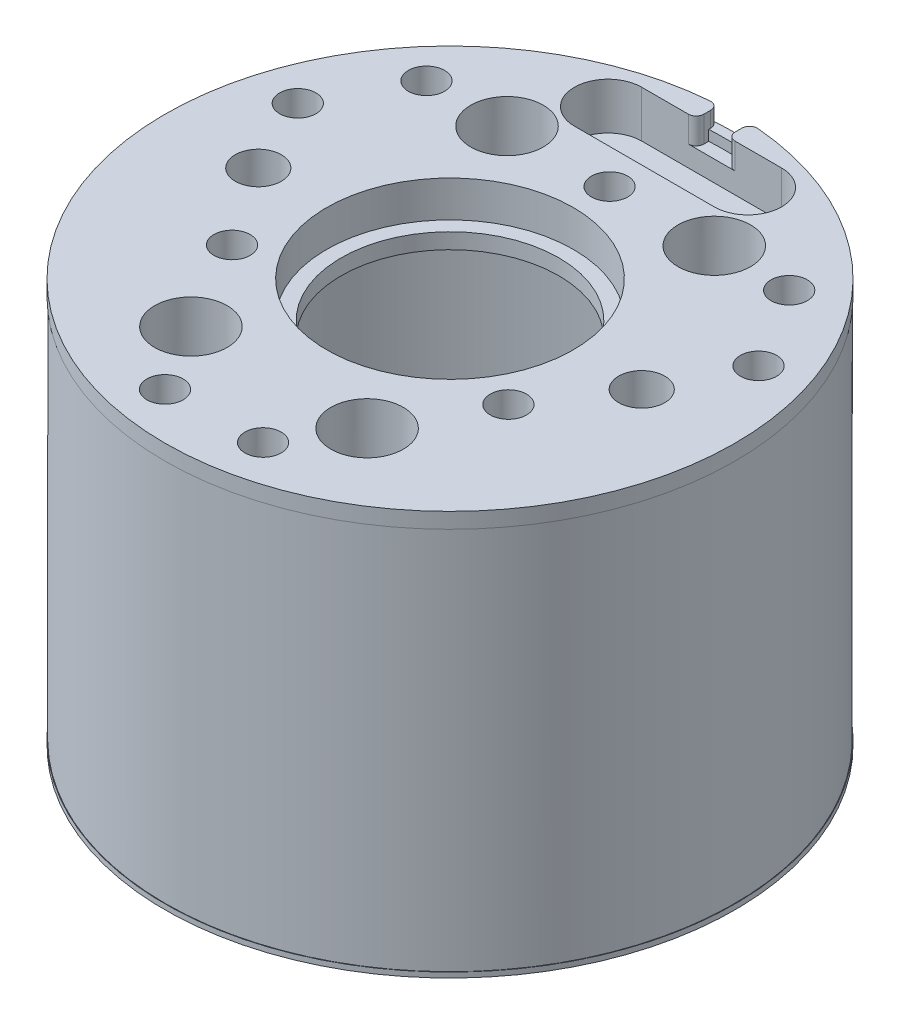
SolidWorks part; units mm, degrees
ref_plane "Front Plane" through (0, 0, 0) normal (0, 0, 1) x (1, 0, 0)
ref_plane "Top Plane" through (0, 0, 0) normal (0, 1, 0) x (1, 0, 0)
ref_plane "Right Plane" through (0, 0, 0) normal (1, 0, 0) x (0, 0, -1)
sketch "Sketch1" plane through (0, 0, 0) normal (0, 0, 1) x (1, 0, 0)
  line L0 (0, 0) -> (0, 37.5247) construction
  line L1 (13.208, -19.812) -> (13.208, 0) construction
  line L2 (13.208, -2.54) -> (13.208, -19.812)
  line L3 (13.208, -2.54) -> (5.334, -2.54)
  line L5 (6.0452, 0) -> (13.97, 0)
  line L6 (13.97, 0) -> (13.97, -0.762)
  line L7 (13.97, -0.762) -> (13.462, -0.762)
  line L8 (13.462, -0.762) -> (13.462, -19.558)
  line L9 (13.462, -19.558) -> (13.97, -19.558)
  line L10 (13.97, -19.558) -> (13.97, -19.812)
  line L11 (13.97, -19.812) -> (13.208, -19.812)
  line L12 (6.0452, 0) -> (6.0452, -1.778)
  line L13 (6.0452, -1.778) -> (5.334, -1.778)
  line L14 (5.334, -1.778) -> (5.334, -2.54)
  dimension "D1" = 19.812
  dimension "D2" = 26.416
  dimension "D3" = 0.762
  dimension "D4" = 2.54
  dimension "D5" = 19.558
  dimension "D6" = 19.812
  dimension "D7" = 27.94
  dimension "D8" = 26.924
  dimension "D9" = 12.0904
  dimension "D10" = 1.778
  dimension "D11" = 10.668
revolve "Body" add sketch "Sketch1" angle 360 about L0
sketch "Mount Holes 1" plane through (0, 0, 0) normal (0, 1, 0) x (1, 0, 0)
  line L0 (-13.5476, 7.8217) -> (13.5476, 7.8217) construction
  line L1 (13.5476, 7.8217) -> (0, -15.6435) construction
  line L2 (0, -15.6435) -> (-13.5476, 7.8217) construction
  line L3 (-13.5476, 7.8217) -> (0, 0) construction
  line L4 (0, 0) -> (13.5476, 7.8217) construction
  line L5 (0, 0) -> (0, -15.6435) construction
  line L6 (0, 0) -> (-2.286, -11.684) construction
  line L7 (0, 0) -> (-6.7738, -3.9109) construction
  line L8 (0, 0) -> (-11.176, 3.7139) construction
  line L10 (0, 0) -> (-9.398, 0) construction
  line L11 (0, 0) -> (9.398, 0) construction
  dimension "D1" = 11.684
  dimension "D2" = 2.286
  dimension "D3" = 6.7738
  dimension "D4" = 11.176
  dimension "D5" = 9.398
hole_wizard "#2-56 Tapped Hole1" positions "3DSketch1" profile "Sketch3" tap size "#2-56" standard "Ansi Inch"
sketch3d "3DSketch1"
  point P0 (-6.7738, 0, 3.9109)
  point P3 (-11.176, 0, -3.7139)
  point P6 (-2.286, 0, 11.684)
sketch "Sketch3" plane through (-6.7738, 0, 3.9109) normal (1, 0, 0) x (0, 0, 1)
  line L0 (0, 0) -> (0, 19.812)
  line L1 (0, 19.812) -> (0.889, 19.812)
  line L2 (0.889, 19.812) -> (0.889, 0)
  line L5 (0.889, 0) -> (0, 0)
  line L11 (0, -6.35) -> (0, 107.95) construction
  dimension "Thru Tap Drill Dia." = 1.778
  dimension "Thru Tap Drill Depth" = 19.812
pattern_circular "CirPattern1" count 3 over 360 about axis through (0, 0, 0) along (0, 1, 0) of "#2-56 Tapped Hole1"
hole_wizard "#4-40 Tapped Hole1" positions "3DSketch2" profile "Sketch4" tap size "#4-40" standard "Ansi Inch"
sketch3d "3DSketch2"
  point P0 (-9.398, 0, 0)
  point P3 (9.398, 0, 0)
sketch "Sketch4" plane through (-9.398, 0, 0) normal (1, 0, 0) x (0, 0, 1)
  line L0 (0, 0) -> (0, 8.2992)
  line L1 (0, 8.2992) -> (1.1303, 7.62)
  line L2 (1.1303, 7.62) -> (1.1303, 0)
  line L5 (1.1303, 0) -> (0, 0)
  line L10 (0, 8.2992) -> (-1.1303, 7.62) construction
  line L11 (0, -6.35) -> (0, 107.95) construction
  dimension "Tap Drill Dia." = 2.2606
  dimension "Tap Drill Depth" = 7.62
  dimension "Drill Angle" = 118
sketch "Sketch5" plane through (0, 0, 0) normal (0, 1, 0) x (1, 0, 0)
  line L0 (-5.08, 7.874) -> (5.08, 7.874) construction
  line L1 (0, 7.874) -> (0, 0) construction
  line L2 (-4.318, -8.382) -> (4.318, -8.382) construction
  line L3 (0, -8.382) -> (0, 0) construction
  circle A0 centre (-5.08, 7.874) radius 1.778
  circle A1 centre (5.08, 7.874) radius 1.778
  circle A2 centre (-4.318, -8.382) radius 1.778
  circle A3 centre (4.318, -8.382) radius 1.778
  dimension "D1" = 3.556
  dimension "D2" = 7.874
  dimension "D3" = 5.08
  dimension "D4" = 4.318
  dimension "D5" = 8.382
extrude "4 Holes" cut sketch "Sketch5" against normal through all
sketch "Sketch6" plane through (0, 0, 0) normal (0, 1, 0) x (1, 0, 0)
  line L0 (-3.429, 11.176) -> (3.429, 11.176) construction
  line L1 (-3.429, 12.827) -> (3.429, 12.827)
  line L2 (-3.429, 9.525) -> (3.429, 9.525)
  line L3 (5.08, 11.176) -> (5.08, 16.627) construction
  line L4 (5.08, 16.627) -> (-5.08, 16.627) construction
  line L5 (-5.08, 16.627) -> (-5.08, 11.176) construction
  line L6 (0, 11.176) -> (0, 0) construction
  arc A0 (-3.429, 12.827) -> (-3.429, 9.525) centre (-3.429, 11.176) ccw
  arc A1 (3.429, 9.525) -> (3.429, 12.827) centre (3.429, 11.176) ccw
  point P2 (0, 11.176)
  dimension "D1" = 1.651
  dimension "D2" = 10.16
  dimension "D3" = 11.176
extrude "Slot" cut sketch "Sketch6" against normal blind 2.286
sketch "Sketch7" plane through (0, 0, 0) normal (0, 1, 0) x (1, 0, 0)
  line L0 (0, 12.827) -> (0, 0) construction
  line L1 (-0.762, 13.97) -> (0.762, 13.97)
  line L2 (-0.762, 13.97) -> (-0.762, 12.827)
  line L3 (-0.762, 12.827) -> (0.762, 12.827)
  line L4 (0.762, 13.97) -> (0.762, 12.827)
  line L5 (3.429, 12.827) -> (-3.429, 12.827) construction
  circle A0 centre (0, 0) radius 13.97 construction
  dimension "D1" = 1.524
extrude "Notch" cut sketch "Sketch7" against normal blind 1.27
fillet "Notch Fillet" radius 0.381 4 edges at (0.762, -0.381, -13.9492) (-0.762, -0.381, -13.9492) (0.762, -0.635, -12.827) (-0.762, -0.635, -12.827)
sketch "Sketch8" plane through (0, 0, 0) normal (0, 0, 1) x (1, 0, 0)
  line L0 (13.462, -19.558) -> (13.462, -0.762) construction
  line L1 (13.462, -0.762) -> (13.9446, -0.762)
  line L2 (13.462, -0.762) -> (13.462, -19.558)
  line L3 (13.462, -19.558) -> (13.9446, -19.558)
  line L4 (13.9446, -0.762) -> (13.9446, -19.558)
  line L5 (13.97, -19.558) -> (-13.97, -19.558) construction
  line L6 (-13.97, -0.762) -> (13.97, -0.762) construction
  line L7 (0, 0) -> (0, -12) construction
  dimension "D1" = 0.0254
revolve "Coils" add sketch "Sketch8" angle 360 about L7
